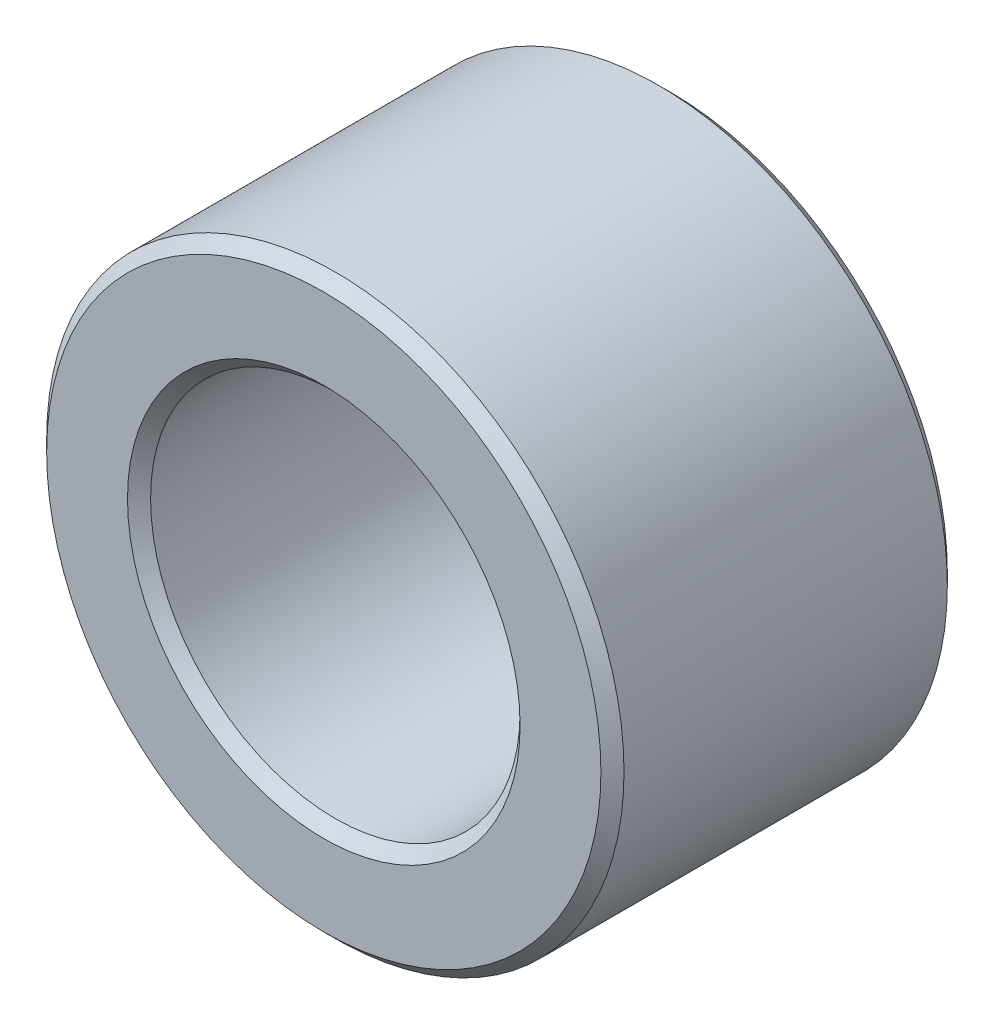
SolidWorks part; units mm, degrees
ref_plane "Front Plane" through (0, 0, 0) normal (0, 0, 1) x (1, 0, 0)
ref_plane "Top Plane" through (0, 0, 0) normal (0, 1, 0) x (1, 0, 0)
ref_plane "Right Plane" through (0, 0, 0) normal (1, 0, 0) x (0, 0, -1)
sketch "Sketch1" plane through (0, 0, 0) normal (0, 0, 1) x (1, 0, 0)
  circle A0 centre (0, 0) radius 5
  circle A1 centre (0, 0) radius 3.2
  dimension "D1" = 10
  dimension "D2" = 6.4
extrude "Boss-Extrude2" add sketch "Sketch1" along normal mid plane 6
chamfer "Chamfer3" distance 0.2 angle 45 4 edges at (5, 0, 3) (5, 0, -3) (3.2, 0, -3) (3.2, 0, 3)
